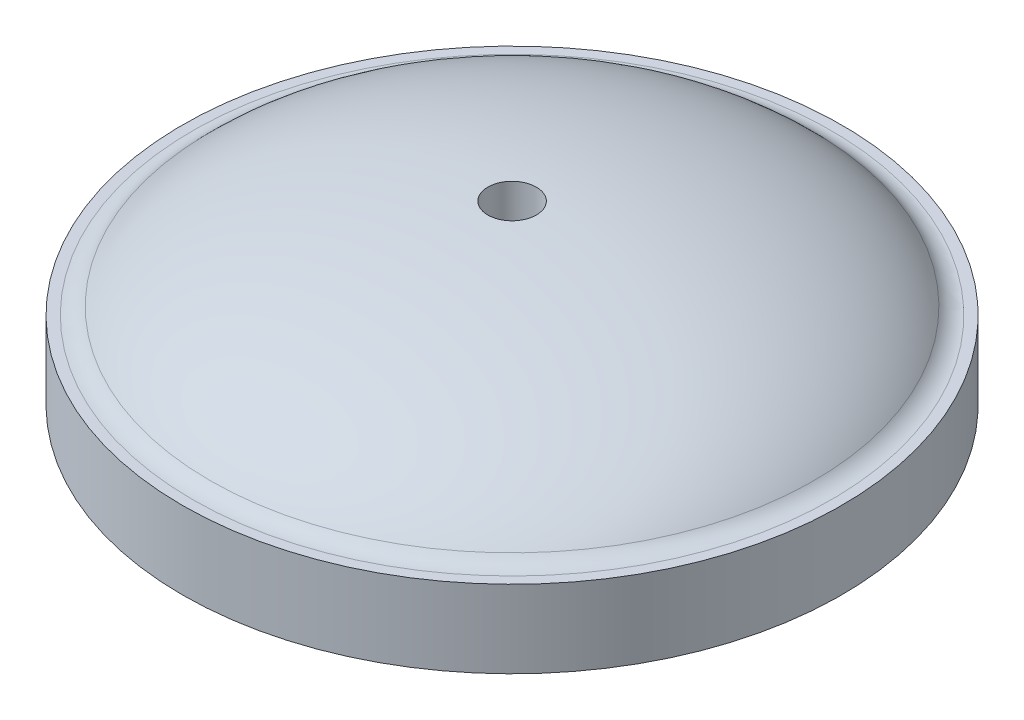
SolidWorks part; units mm, degrees
ref_plane "Plane1" through (0, 0, 0) normal (0, 0, 1) x (1, 0, 0)
ref_plane "Plane2" through (0, 0, 0) normal (0, 1, 0) x (1, 0, 0)
ref_plane "Plane3" through (0, 0, 0) normal (1, 0, 0) x (0, 0, -1)
sketch "Sketch2" plane through (0, 0, 0) normal (0, 0, 1) x (1, 0, 0)
  line L0 (-92.202, 0) -> (106.172, 0) construction
  line L1 (0, 86.36) -> (0, -75.946) construction
  line L2 (15.875, 33.1582) -> (15.875, 5.9944)
  line L4 (8.2296, 6.5024) -> (12.7, 6.5024) construction
  line L5 (71.5, 9.9101) -> (71.5, 5.9944)
  line L6 (71.5, 6.5024) -> (78.74, 6.5024) construction
  line L8 (82.55, -6.1976) -> (82.55, 5.9944)
  line L11 (3.5553, 5.9944) -> (2.8175, 37.4541)
  line L15 (2.65, 40.9956) -> (12.7, 40.9956) construction
  line L17 (15.875, 5.9944) -> (3.5553, 5.9944)
  line L18 (83.7107, 14.1224) -> (86.36, 14.1224)
  line L19 (82.55, 6.246) -> (82.55, -20.574) construction
  line L20 (82.55, -6.1976) -> (86.36, -6.1976)
  line L21 (71.5, 5.9944) -> (82.55, 5.9944)
  line L30 (86.36, 14.1224) -> (86.36, -6.1976)
  arc A0 (71.5, 9.9101) -> (64.5047, 21.2567) centre (58.8, 9.9101) ccw
  arc A1 (2.8175, 37.4541) -> (5.4312, 40.0526) centre (5.3568, 37.5136) cw
  arc A10 (79.092, 16.1147) -> (83.7107, 14.1224) centre (83.7107, 20.4724) ccw
  ellipse E0 centre (0, 0) end of major axis (86.36, 0) minor radius 40.132 (79.092, 16.1147) -> (5.4312, 40.0526) ccw
  ellipse E2 centre (0, 0) end of major axis (82.9945, 0) minor radius 33.782 (64.5047, 21.2567) -> (15.875, 33.1582) ccw
  point P19 (82.55, 5.9944)
  point P59 (2.413, 30.0736)
  point P63 (3.556, 21.2344)
  dimension "D11" = 12.7
  dimension "D36" = 6.35
  dimension "D9" = 2.54
  dimension "D1" = 40.132
  dimension "D4" = 165.989
  dimension "D5" = 6.5024
  dimension "D6" = 6.35
  dimension "D7" = 143
  dimension "D8" = 3.81
  dimension "D12" = 3.9157
  dimension "D13" = 27.1638
  dimension "D16" = 40.9956
  dimension "D17" = 5.3
  dimension "D21" = 82.55
  dimension "D22" = 12.7
  dimension "D24" = 0.508
  dimension "D27" = 34.4932
  dimension "D28" = 31.75
  dimension "D30" = 15.24
  dimension "D34" = 7.62
revolve "Base-Revolve" add sketch "Sketch2" angle 360 about L1
ref_plane "Plane7" through (0, 7.5184, 0) normal (0, -1, 0) x (1, 0, 0)
sketch "Sketch3" plane through (0, 5.9944, 0) normal (0, -1, 0) x (1, 0, 0)
  line L0 (-49.7114, 51.3909) -> (-9.922, 12.3923)
  line L3 (-78.4852, 76.9253) -> (77.1932, -75.659) construction
  line L16 (-52.3783, 48.6699) -> (-12.5889, 9.6713)
  arc A2 (-9.922, 12.3923) -> (-12.5889, 9.6713) centre (0, 0) ccw
  circle A4 centre (0, 0) radius 15.875 construction
  circle A8 centre (0, 0) radius 71.5 construction
  arc A9 (-52.3783, 48.6699) -> (-49.7114, 51.3909) centre (0, 0) cw
  dimension "D1" = 3.81
extrude "Ribs Extrude" add sketch "Sketch3" against normal up to surface (11.1585 mm away)
pattern_circular "CirPattern1" count 5 over 360 about axis through (0, 0, 0) along (0, 1, 0) of "Ribs Extrude"
sketch "Sketch6" plane through (0, 5.9944, 0) normal (0, -1, 0) x (1, 0, 0)
  circle A1 centre (0, 0) radius 6.35
extrude "Cut-Extrude1" cut sketch "Sketch6" against normal through all
sketch "Sketch7" plane through (0, 5.9944, 0) normal (0, -1, 0) x (1, 0, 0)
  circle A2 centre (0, 0) radius 77.47
  circle A3 centre (0, 0) radius 77.47
  dimension "D1" = 5.08
fillet "Fillet1" radius 1.524 45 edges at (70.9824, 7.9523, -8.5876) (69.8372, 15.2068, -8.4179) (30.102, 7.9523, 64.8546) (29.5868, 15.2068, 63.8179) (-64.2373, 7.9523, -31.3977) (-61.7713, 17.8413, -30.1099) (10.0106, 7.9523, -70.7957) (9.5478, 17.8413, -68.0524) (13.7675, 7.9523, -70.162) (13.575, 15.2068, -69.0205) (70.4242, 7.9523, -12.3564) (67.6722, 17.8413, -11.9488) (-62.4736, 7.9523, -34.7749) (-61.4475, 15.2068, -34.239) (33.5139, 7.9523, 63.159) (32.2759, 17.8413, 60.6677) (-49.7114, 7.9523, 51.3909) (-47.7246, 17.8413, 49.4435) (-52.3783, 7.9523, 48.6699) (-51.5516, 15.2068, 47.8596) (4.5, 19.5763, -15.2238) (15.3111, 19.5763, -4.1935) (-13.0882, 19.5763, -8.9842) (0.7431, 19.5763, -15.8576) (-12.5889, 19.5763, 9.6713) (-9.922, 19.5763, 12.3923) (-14.8518, 19.5763, -5.607) (5.3078, 19.5763, 14.9614) (15.8693, 19.5763, -0.4247) (8.7197, 19.5763, 13.2658) (50.4492, 26.7292, -5.5463) (-2.6406, 33.1582, 15.6538) (20.8645, 26.7292, 46.2661) (-15.7037, 33.1582, 2.3259) (-42.4507, 27.8613, -20.0201) (5.9222, 27.8613, -46.5596) (-7.0648, 33.1582, -14.2164) (14.0717, 33.1582, 7.3487) (11.3374, 33.1582, -11.1121) (10.3148, 26.7292, -49.6939) (46.1109, 27.8613, -8.7553) (-44.0743, 26.7292, -25.1662) (22.5759, 27.8613, 41.1485) (-32.1582, 27.8613, 34.1865) (-37.5542, 26.7292, 34.1404)
